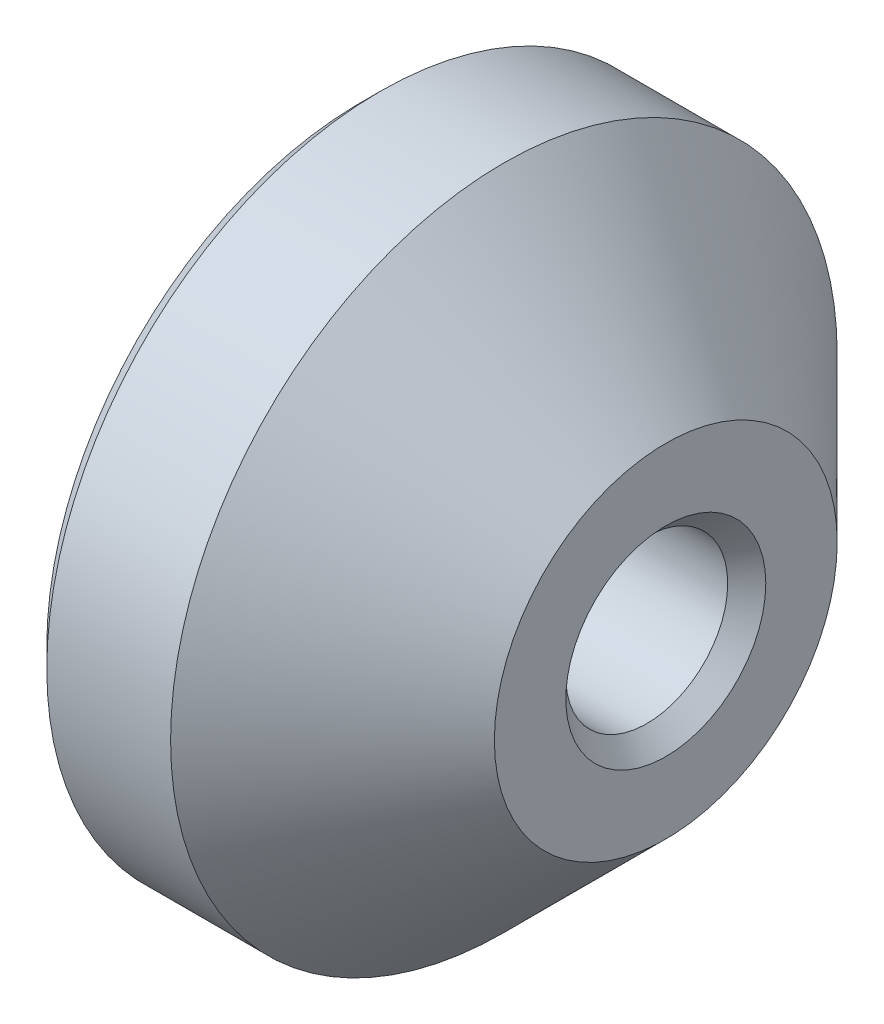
SolidWorks part; units mm, degrees
ref_plane "Vorne" through (0, 0, 0) normal (0, 0, 1) x (1, 0, 0)
ref_plane "Oben" through (0, 0, 0) normal (0, 1, 0) x (1, 0, 0)
ref_plane "Rechts" through (0, 0, 0) normal (1, 0, 0) x (0, 0, -1)
sketch "Skizze1" plane through (0, 0, 0) normal (0, 0, 1) x (1, 0, 0)
  line L0 (0, 0) -> (-38.8355, 0) construction
  line L1 (0, 0) -> (0, 9)
  line L2 (0, 9) -> (-8.5, 17.5)
  line L3 (-8.5, 17.5) -> (-16, 17.5)
  line L4 (-16, 17.5) -> (-16, 0)
  line L5 (0, 0) -> (-16, 0)
  dimension "D1" = 35
  dimension "D2" = 18
  dimension "D3" = 16
  dimension "D4" = 45
revolve "Rotation1" add sketch "Skizze1" angle 360 about L0
hole_wizard "M10 Gewindekernloch1" positions "Skizze3" profile "Skizze2" tap size "M10" standard "DIN"
sketch "Skizze3" plane through (0, 0, 0) normal (1, 0, 0) x (0, 0, -1)
  point P0 (0, 0)
sketch "Skizze2" plane through (0, 0, 0) normal (0, 1, 0) x (0, 0, -1)
  line L0 (0, 0) -> (0, 16)
  line L1 (0, 16) -> (4.25, 16)
  line L2 (4.25, 16) -> (4.25, 0)
  line L5 (4.25, 0) -> (0, 0)
  line L11 (0, -6.35) -> (0, 107.95) construction
  dimension "Bohrerdurchmesser" = 8.5
  dimension "Bohrungstiefe" = 16
chamfer "Fase1" distance 1 angle 45 3 edges at (-16, 0, -17.5) (-16, 0, -4.25) (0, 0, -4.25)
